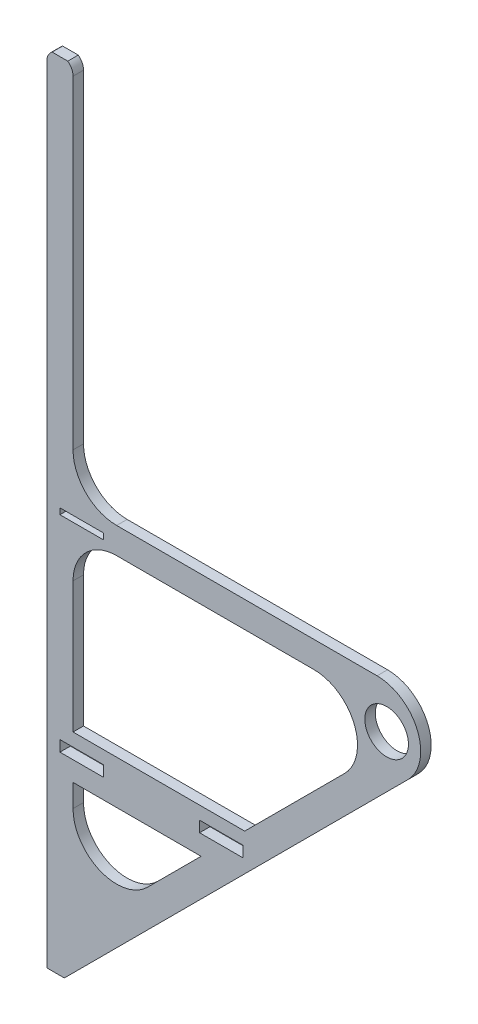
SolidWorks part; units mm, degrees
ref_plane "Front Plane" through (0, 0, 0) normal (0, 0, 1) x (1, 0, 0)
ref_plane "Top Plane" through (0, 0, 0) normal (0, 1, 0) x (1, 0, 0)
ref_plane "Right Plane" through (0, 0, 0) normal (1, 0, 0) x (0, 0, -1)
sketch "Sketch1" plane through (0, 0, 0) normal (0, 0, 1) x (1, 0, 0)
  line L0 (0, 450) -> (0, 0)
  line L1 (0, 0) -> (20, 0)
  line L2 (20, 0) -> (413.7942, 393.7942)
  line L3 (378.4389, 479.1496) -> (80, 479.1496)
  line L4 (80, 449.1496) -> (306.0125, 449.1496)
  line L5 (341.3678, 363.7942) -> (226.7232, 249.1496)
  line L6 (30, 173.1371) -> (30, 199.1496)
  line L7 (0, 900) -> (0, 450)
  line L8 (30, 249.1496) -> (226.7232, 249.1496)
  line L9 (30, 900) -> (30, 529.1496)
  line L10 (6, 912) -> (24, 912)
  line L11 (30, 199.1496) -> (176.7232, 199.1496)
  line L12 (30, 249.1496) -> (30, 399.1496)
  line L19 (176.7232, 199.1496) -> (115.3553, 137.7817)
  line L21 (15, 457.2947) -> (65, 457.2947)
  line L22 (15, 457.2947) -> (15, 464.1496)
  line L23 (15, 464.1496) -> (65, 464.1496)
  line L24 (65, 457.2947) -> (65, 464.1496)
  arc A0 (0, 900) -> (6, 912) centre (15, 900) cw
  arc A1 (24, 912) -> (30, 900) centre (15, 900) cw
  arc A2 (80, 479.1496) -> (30, 529.1496) centre (80, 529.1496) cw
  arc A3 (80, 449.1496) -> (30, 399.1496) centre (80, 399.1496) ccw
  arc A4 (341.3678, 363.7942) -> (306.0125, 449.1496) centre (306.0125, 399.1496) ccw
  arc A5 (413.7942, 393.7942) -> (378.4389, 479.1496) centre (378.4389, 429.1496) ccw
  arc A6 (30, 173.1371) -> (115.3553, 137.7817) centre (80, 173.1371) ccw
  circle A7 centre (389.3943, 429.1496) radius 25
  point P18 (30, 449.1496)
  point P21 (426.7232, 449.1496)
  point P24 (499.1496, 479.1496)
  point P27 (30, 52.4264)
  dimension "D10" = 15
  dimension "D12" = 50
  dimension "D13" = 50
  dimension "D14" = 50
  dimension "D15" = 50
  dimension "D16" = 50
  dimension "D20" = 50
  dimension "D18" = 50
  dimension "D1" = 500
  dimension "D2" = 45
  dimension "D3" = 450
  dimension "D4" = 20
  dimension "D5" = 30
  dimension "D6" = 30
  dimension "D7" = 30
  dimension "D8" = 30
  dimension "D9" = 30
  dimension "D11" = 18
  dimension "D17" = 50
  dimension "D21" = 15
  dimension "D22" = 200
  dimension "D23" = 450
  dimension "D24" = 15
extrude "Boss-Extrude2" add sketch "Sketch1" along normal blind 12
sketch "Sketch2" plane through (0, 0, 12) normal (0, 0, 1) x (1, 0, 0)
  line L0 (30, 249.1496) -> (226.7232, 249.1496) construction
  line L1 (15, 234.1496) -> (65, 234.1496)
  line L2 (15, 234.1496) -> (15, 221.6496)
  line L3 (15, 221.6496) -> (65, 221.6496)
  line L4 (65, 234.1496) -> (65, 221.6496)
  line L5 (175, 234.1496) -> (225, 234.1496)
  line L6 (175, 234.1496) -> (175, 221.6496)
  line L7 (175, 221.6496) -> (225, 221.6496)
  line L8 (225, 234.1496) -> (225, 221.6496)
  line L9 (0, 900) -> (0, 0) construction
  dimension "D1" = 50
  dimension "D2" = 12.5
  dimension "D3" = 50
  dimension "D4" = 12.5
  dimension "D5" = 15
  dimension "D6" = 15
  dimension "D7" = 15
  dimension "D8" = 110
extrude "Cut-Extrude1" cut sketch "Sketch2" against normal blind 12
